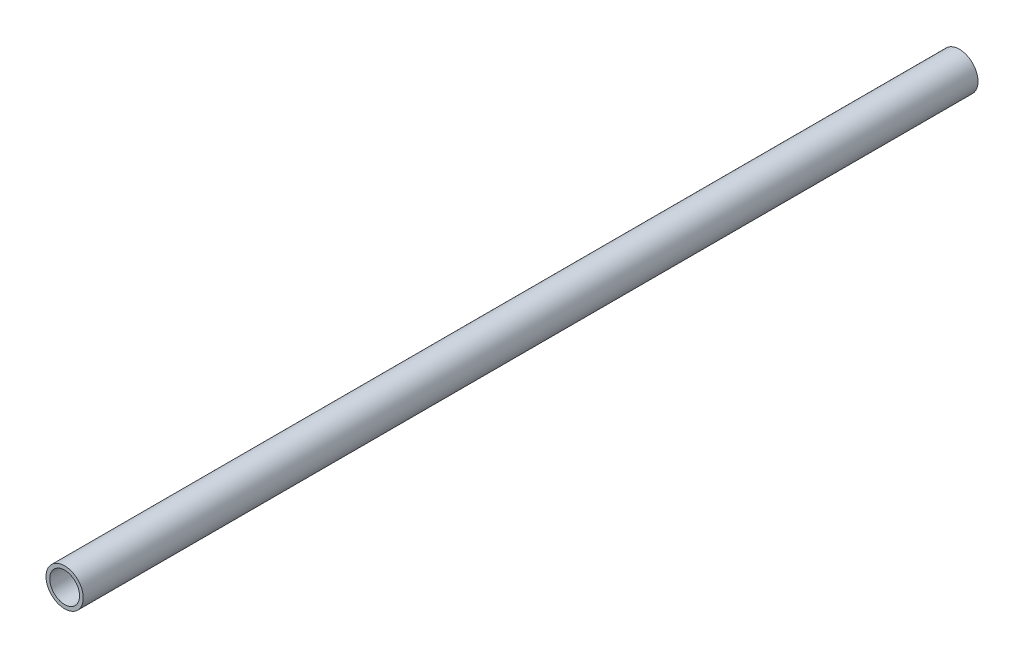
SolidWorks part; units mm, degrees
ref_plane "Front Plane" through (0, 0, 0) normal (0, 0, 1) x (1, 0, 0)
ref_plane "Top Plane" through (0, 0, 0) normal (0, 1, 0) x (1, 0, 0)
ref_plane "Right Plane" through (0, 0, 0) normal (1, 0, 0) x (0, 0, -1)
sketch "Sketch1" plane through (0, 0, 0) normal (0, 0, 1) x (1, 0, 0)
  circle A0 centre (0, 0) radius 6.35
  circle A1 centre (0, 0) radius 5.08
  dimension "D1" = 12.7
  dimension "D2" = 10.16
extrude "Boss-Extrude1" add sketch "Sketch1" along normal mid plane 304.8
